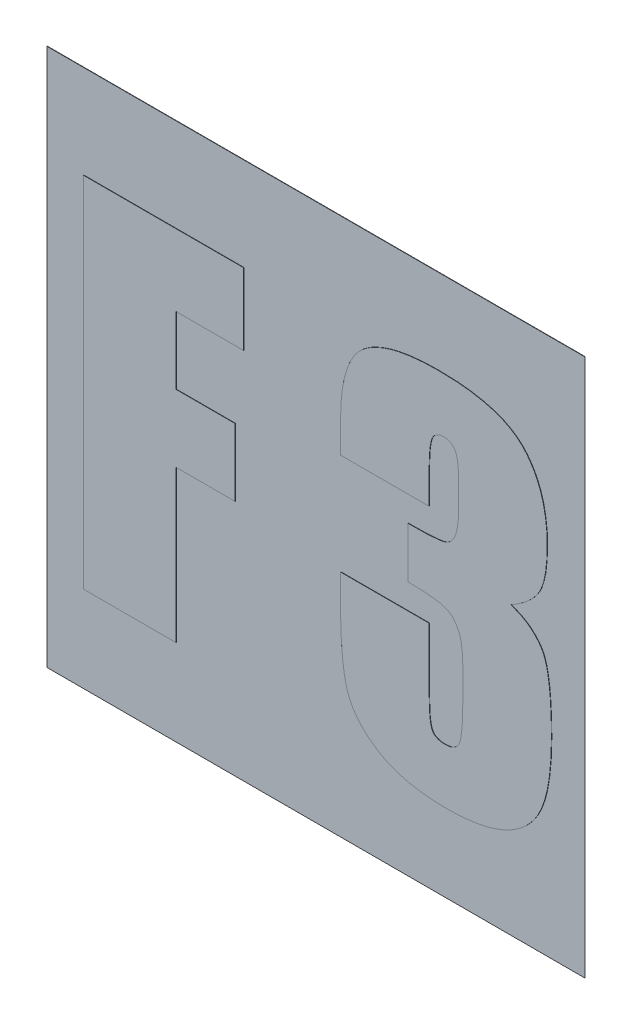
SolidWorks part; units mm, degrees
ref_plane "Plane1" through (0, 0, 0) normal (0, 0, 1) x (1, 0, 0)
ref_plane "Plane2" through (0, 0, 0) normal (0, 1, 0) x (1, 0, 0)
ref_plane "Plane3" through (0, 0, 0) normal (1, 0, 0) x (0, 0, -1)
sketch "Sketch1" plane through (0, 0, 0) normal (0, 0, 1) x (1, 0, 0)
  line L0 (-69.0098, 0) -> (69.0098, 0) construction
  line L1 (0, 52.3212) -> (0, -57.1323) construction
  line L2 (-7.5, 7.5) -> (7.5, 7.5)
  line L3 (-7.5, 7.5) -> (-7.5, -7.5)
  line L4 (7.5, 7.5) -> (7.5, -7.5)
  line L5 (-7.5, -7.5) -> (7.5, -7.5)
  point P8 (0, -7.5)
  point P11 (0, 7.5)
  point P12 (7.5, 0)
  point P13 (-7.5, 0)
  dimension "D1" = 15
  dimension "D2" = 15
extrude "Base-Extrude" add sketch "Sketch1" along normal blind 0.01
sketch "Sketch3" plane through (0, 0, 0.01) normal (0, 0, 1) x (1, 0, 0)
  text T0 "F 3" font "Impact" height in points 36
  point P1 (0, 0)
extrude "Boss-Extrude1" add sketch "Sketch3" along normal blind 0.01
